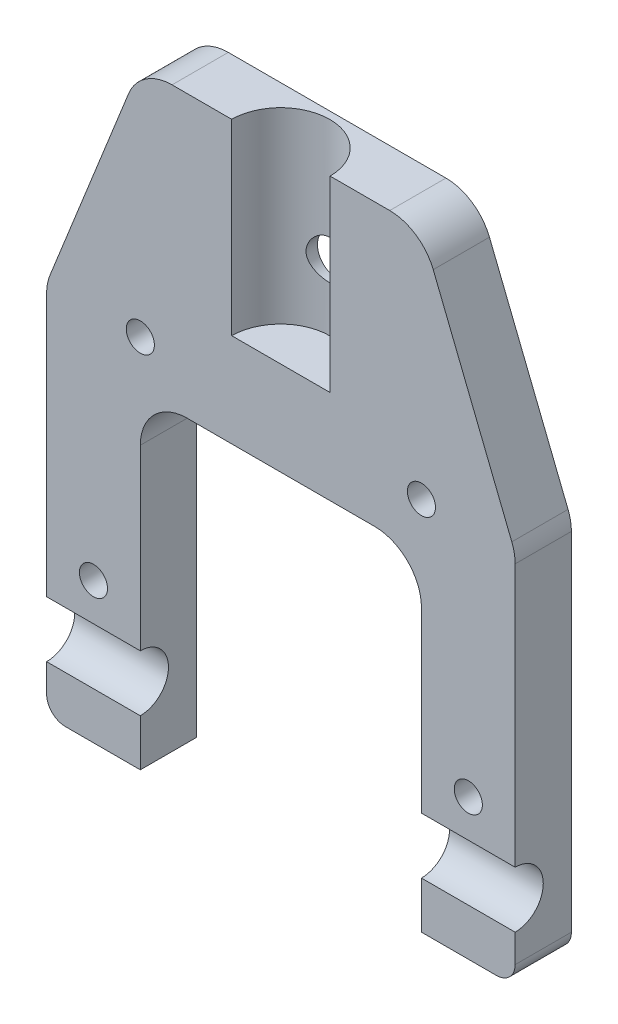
SolidWorks part; units mm, degrees
ref_plane "Plan de face" through (0, 0, 0) normal (0, 0, 1) x (1, 0, 0)
ref_plane "Plan de dessus" through (0, 0, 0) normal (0, 1, 0) x (1, 0, 0)
ref_plane "Plan de droite" through (0, 0, 0) normal (1, 0, 0) x (0, 0, -1)
sketch "Esquisse1" plane through (0, 0, 0) normal (0, 0, 1) x (1, 0, 0)
  line L0 (0, -9.4359) -> (0, 54.0267) construction
  line L1 (-9.1019, 0) -> (56.0307, 0) construction
  line L2 (50, -8.0998) -> (50, 54.0267) construction
  line L3 (10, -9.4359) -> (10, 70) construction
  line L4 (40, -8.0998) -> (40, 70) construction
  line L5 (6.2628, 35) -> (43.6722, 35) construction
  line L6 (-6.9308, 40) -> (53.3586, 40) construction
  line L7 (-3.4236, 65) -> (59.8719, 65) construction
  line L8 (0, 2) -> (0, 39.0371)
  line L9 (0.3576, 40.894) -> (8.7428, 61.857)
  line L10 (13.3852, 65) -> (36.6148, 65)
  line L11 (41.2572, 61.857) -> (49.6424, 40.894)
  line L12 (50, 39.0371) -> (50, 2)
  line L13 (48, 0) -> (2, 0)
  line L14 (25, -4.2587) -> (25, 70) construction
  line L15 (-5.5556, 15) -> (51.4147, 15) construction
  line L16 (45, 18.3834) -> (45, 11.0367) construction
  line L17 (5, 18.3834) -> (5, 11.0367) construction
  line L18 (19.7963, 52) -> (30.6725, 52) construction
  line L19 (13.3852, 45) -> (35.239, 45) construction
  arc A0 (0, 39.0371) -> (0.3576, 40.894) centre (5, 39.0371) cw
  arc A1 (49.6424, 40.894) -> (50, 39.0371) centre (45, 39.0371) cw
  arc A2 (36.6148, 65) -> (41.2572, 61.857) centre (36.6148, 60) cw
  arc A3 (8.7428, 61.857) -> (13.3852, 65) centre (13.3852, 60) cw
  circle A4 centre (10, 40) radius 1.5
  circle A5 centre (40, 40) radius 1.5
  circle A6 centre (5, 15) radius 1.5
  circle A7 centre (45, 15) radius 1.5
  circle A8 centre (25, 52) radius 2.1
  arc A9 (50, 2) -> (48, 0) centre (48, 2) cw
  arc A10 (0, 2) -> (2, 0) centre (2, 2) ccw
  point P25 (0, 40)
  point P26 (0, 40)
  point P28 (10, 65)
  point P30 (50, 40)
  point P31 (40, 65)
  point P34 (50, 40)
  point P51 (40, 65)
  point P54 (10, 65)
  point P63 (50, 0)
  point P66 (0, 0)
  dimension "D1" = 5
  dimension "D2" = 2
extrude "Extrusion1" add sketch "Esquisse1" along normal blind 6
sketch "Esquisse4" plane through (0, 65, 0) normal (0, 1, 0) x (-1, 0, 0)
  line L0 (-25, 9.545) -> (-25, -4.9525) construction
  circle A0 centre (-25, 6.0262) radius 5.25
extrude "Enlèv. mat.-Extru.2" cut sketch "Esquisse4" against normal blind 20
sketch "Esquisse5" plane through (0, 0, 6) normal (0, 0, 1) x (1, 0, 0)
  line L0 (10, -1.5862) -> (10, 36) construction
  line L1 (40, -1.5862) -> (40, 31.8078) construction
  line L2 (-3.4851, 35) -> (52.884, 35) construction
  line L3 (2, 0) -> (48, 0) construction
  line L4 (15, 35) -> (35, 35)
  line L5 (10, 30) -> (10, 0)
  line L6 (10, 0) -> (40, 0)
  line L7 (40, 30) -> (40, 0)
  arc A0 (35, 35) -> (40, 30) centre (35, 30) cw
  arc A1 (15, 35) -> (10, 30) centre (15, 30) ccw
  point P16 (10, 35)
  dimension "D1" = 5
extrude "Enlèv. mat.-Extru.3" cut sketch "Esquisse5" against normal blind 10
sketch "Esquisse6" plane through (50, 0, 0) normal (1, 0, 0) x (0, 0, -1)
  line L0 (-10.2222, 8) -> (4.3801, 8) construction
  circle A0 centre (-6, 8) radius 3
extrude "Enlèv. mat.-Extru.4" cut sketch "Esquisse6" against normal through all
